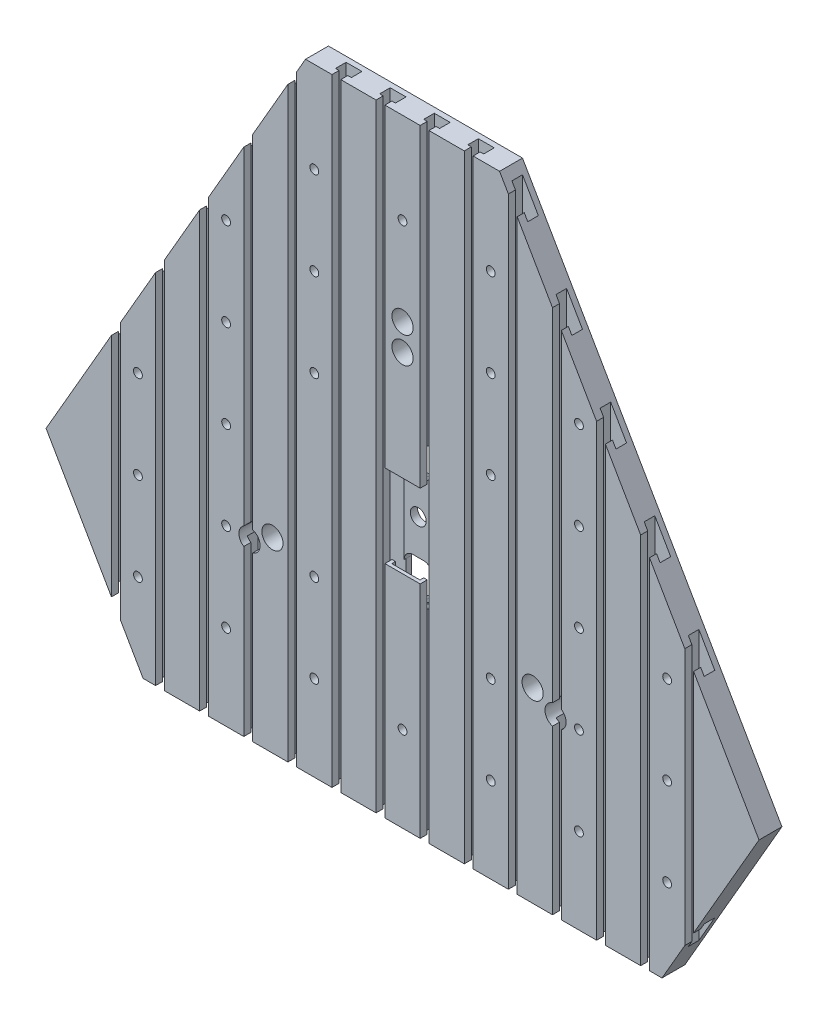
SolidWorks part; units mm, degrees
ref_plane "Plan de face" through (0, 0, 0) normal (0, 0, 1) x (1, 0, 0)
ref_plane "Plan de dessus" through (0, 0, 0) normal (0, 1, 0) x (1, 0, 0)
ref_plane "Plan de droite" through (0, 0, 0) normal (1, 0, 0) x (0, 0, -1)
sketch "Esquisse1" plane through (0, 0, 0) normal (0, 0, 1) x (1, 0, 0)
  line L6 (35.7636, 358.7862) -> (-423.8647, -437.3133) construction
  line L7 (-755.4678, -148.4209) -> (879.7592, -148.4209) construction
  line L8 (-46.1325, 376.7457) -> (415.4529, -422.7436) construction
  line L9 (257.0726, -148.4209) -> (-245.0999, 141.5085) construction
  line L10 (-257.0726, -148.4209) -> (263.2247, 151.9729) construction
  line L11 (-55, 201.5791) -> (55, 201.5791)
  line L12 (-147.0726, -148.4209) -> (147.0726, -148.4209)
  line L13 (147.0726, -148.4209) -> (202.0726, -53.1581)
  line L14 (202.0726, -53.1581) -> (55, 201.5791)
  line L15 (-147.0726, -148.4209) -> (-202.0726, -53.1581)
  line L16 (-202.0726, -53.1581) -> (-55, 201.5791)
  dimension "D1" = 60
  dimension "D2" = 60
  dimension "D3" = 110
  dimension "D4" = 350
  dimension "D5" = 60
  dimension "D6" = 60
  dimension "D7" = 110
  dimension "D8" = 110
extrude "Boss.-Extru.2" add sketch "Esquisse1" along normal blind 13
sketch "Esquisse3" plane through (0, 201.5791, 0) normal (0, 1, 0) x (1, 0, 0)
  line L0 (-12.5, 6.793) -> (-12.5, -19.2478) construction
  line L1 (-8, -3) -> (-17, -3)
  line L2 (-17, -3) -> (-17, -9)
  line L3 (-17, -9) -> (-15, -9)
  line L4 (-15, -9) -> (-15, -13)
  line L5 (55, -13) -> (-55, -13) construction
  line L6 (-10, -9) -> (-10, -13)
  line L7 (-8, -9) -> (-10, -9)
  line L8 (-8, -3) -> (-8, -9)
  line L9 (-15, -13) -> (-10, -13)
  point P2 (-12.5, -13)
  point P14 (-12.5, -3)
  dimension "D1" = 12.5
  dimension "D2" = 9
  dimension "D3" = 5
  dimension "D4" = 6
  dimension "D5" = 4
extrude "Enlèv. mat.-Extru.1" cut sketch "Esquisse3" against normal up to next
pattern_linear "Répétition linéaire1" count 8 spacing 25 along (1, 0, 0) of "Enlèv. mat.-Extru.1"
pattern_linear "Répétition linéaire2" count 7 spacing 25 along (-1, 0, 0) of "Enlèv. mat.-Extru.1"
sketch "3parties" plane through (0, 0, 0) normal (0, 0, 1) x (1, 0, 0)
  line L2 (-50, 0) -> (-171.3817, 0)
  line L3 (-165, 11.0535) -> (-202.0726, -53.1581) construction
  line L4 (50, 0) -> (171.3817, 0)
  line L5 (202.0726, -53.1581) -> (165, 11.0535) construction
  line L6 (0, -50) -> (0, -148.4209)
  line L7 (-10, -148.4209) -> (10, -148.4209) construction
  circle A0 centre (0, 0) radius 50
  dimension "D1" = 100
sketch "certcleRotules" plane through (0, 0, 13) normal (0, 0, 1) x (1, 0, 0)
  circle A0 centre (0, 0) radius 157.5
  dimension "D1" = 315
sketch "Esquisse6" plane through (0, 0, 0) normal (0, 1, 0) x (1, 0, 0)
  line L0 (-157.5, -13) -> (157.5, -13) construction
  line L1 (0, 0) -> (-4.5, 0)
  line L2 (0, 0) -> (0, -13)
  line L3 (-2.5, -9) -> (-4.5, -9)
  line L4 (-4.5, 0) -> (-4.5, -9)
  line L7 (0, -13) -> (-2.5, -13)
  line L8 (-2.5, -9) -> (-2.5, -13)
  dimension "D1" = 4.5
  dimension "D2" = 2.5
  dimension "D3" = 4
revolve "Enlèvement de matière-Révolution1" cut sketch "Esquisse6" angle 360 about L2
pattern_linear "Répétition linéaire3" count 4 spacing 50 along (0, 1, 0) count 4 spacing 50 along (1, 0, 0) of "Enlèvement de matière-Révolution1"
pattern_linear "Répétition linéaire5" count 3 spacing 50 along (0, -1, 0) count 4 spacing 50 along (1, 0, 0) of "Enlèvement de matière-Révolution1"
pattern_linear "Répétition linéaire6" count 4 spacing 50 along (0, 1, 0) count 4 spacing 50 along (-1, 0, 0) of "Enlèvement de matière-Révolution1"
pattern_linear "Répétition linéaire7" count 3 spacing 50 along (0, -1, 0) count 4 spacing 50 along (-1, 0, 0) of "Enlèvement de matière-Révolution1"
sketch "Esquisse8" plane through (0, 0, 0) normal (0, 0, -1) x (-1, 0, 0)
  circle A0 centre (0, 100) radius 4.5 construction
  circle A1 centre (0, 100) radius 4.5
extrude "bouchonBarreauHaut" add sketch "Esquisse8" against normal blind 13
sketch "Esquisse7" plane through (0, 0, 0) normal (0, 0, -1) x (-1, 0, 0)
  line L1 (-6.5, 105.15) -> (6.5, 105.15)
  line L2 (-6.5, 105.15) -> (-6.5, 80.15)
  line L3 (-6.5, 80.15) -> (6.5, 80.15)
  line L4 (6.5, 105.15) -> (6.5, 80.15)
  line L5 (0, 7.15) -> (0, -7.15) construction
  dimension "D1" = 25
  dimension "D2" = 80.15
  dimension "D3" = 13
  dimension "D4" = 6.5
extrude "Boss.-Extru.4" add sketch "Esquisse7" along normal blind 5
sketch "Esquisse9" plane through (0, 0, 0) normal (1, 0, 0) x (0, 0, -1)
  line L0 (5, 80.15) -> (0, 80.15) construction
  line L1 (5, 80.15) -> (5, 105.15) construction
  line L3 (5, 85.15) -> (5, 82.5)
  line L4 (5, 82.5) -> (-3, 82.5)
  line L6 (-3, -148.4209) -> (-3, 201.5791) construction
  line L7 (-13, 157.5) -> (-13, -157.5) construction
  line L8 (-3, 79.15) -> (-13, 79.15)
  line L9 (-3, 79.15) -> (-3, 82.5)
  line L10 (5, 85.15) -> (-13, 85.15)
  line L11 (-13, 79.15) -> (-13, 85.15)
  dimension "D1" = 5
  dimension "D2" = 2.65
  dimension "D3" = 6
revolve "Enlèvement de matière-Révolution2" cut sketch "Esquisse9" angle 360 about L10
pattern_linear "Répétition linéaire8" count 2 spacing 15 along (0, 1, 0) of "Enlèvement de matière-Révolution2"
pattern_circular "Répétition circulaire1" count 3 every 120 about axis through (0, 0, 0) along (0, 0, 1) of "Boss.-Extru.4", "Enlèvement de matière-Révolution2", "Répétition linéaire8"
sketch "Esquisse10" plane through (0, 0, 0) normal (1, 0, 0) x (0, 0, -1)
  line L0 (0, 201.5791) -> (0, -53.1581) construction
  line L1 (0, 77.5) -> (5, 77.5)
  line L2 (0, 77.5) -> (0, 72.5)
  line L3 (0, 72.5) -> (5, 72.5)
  line L4 (5, 77.5) -> (5, 72.5)
  line L5 (0, 50) -> (0, -50) construction
  line L6 (0, -72.5) -> (5, -72.5)
  line L7 (0, -72.5) -> (0, -77.5)
  line L8 (0, -77.5) -> (5, -77.5)
  line L9 (5, -72.5) -> (5, -77.5)
  line L10 (5, 80.15) -> (5, 105.15) construction
  line L11 (-9, 50) -> (0, 50) construction
  line L13 (-9, -100) -> (0, -100) construction
  point P16 (2.5, 72.5)
  point P19 (2.5, -72.5)
  dimension "D1" = 22.5
  dimension "D2" = 5
  dimension "D3" = 22.5
  dimension "D4" = 5
extrude "Boss.-Extru.6" add sketch "Esquisse10" along normal mid plane 215
chamfer "Chanfrein1" distance 5 angle 60 4 edges at (107.5, -75, -5) (-107.5, -75, -5) (-107.5, 75, -5) (107.5, 75, -5)
sketch "Esquisse11" plane through (0, 0, 13) normal (0, 0, 1) x (1, 0, 0)
  line L0 (-10, -148.4209) -> (-10, 201.5791) construction
  line L1 (-10, 23.5) -> (10, 23.5)
  line L2 (-10, 23.5) -> (-10, -23.5)
  line L3 (-10, -23.5) -> (10, -23.5)
  line L4 (10, 23.5) -> (10, -23.5)
  line L5 (10, -148.4209) -> (10, 201.5791) construction
  dimension "D1" = 47
  dimension "D2" = 23.5
extrude "Enlèv. mat.-Extru.2" cut sketch "Esquisse11" against normal blind 8.9
sketch "Esquisse13" plane through (-8, 0, 0) normal (-1, 0, 0) x (0, 0, 1)
  line L1 (4.1, -23.5) -> (11.1, -23.5)
  line L2 (4.1, -23.5) -> (4.1, -40)
  line L3 (4.1, -40) -> (6.1, -40)
  line L4 (11.1, -23.5) -> (11.1, -35)
  arc A0 (6.1, -40) -> (11.1, -35) centre (6.1, -35) ccw
  dimension "D2" = 5
  dimension "D1" = 16.5
  dimension "D3" = 7
extrude "Enlèv. mat.-Extru.3" cut sketch "Esquisse13" against normal up to surface (16 mm away)
sketch "Esquisse14" plane through (0, 0, 4.1) normal (0, 0, 1) x (1, 0, 0)
  line L0 (-8, 23.5) -> (-8, -40) construction
  line L1 (-3, -20) -> (3, -20)
  line L2 (-8, -25) -> (-8, -35)
  line L3 (-3, -40) -> (3, -40)
  line L4 (8, -25) -> (8, -35)
  line L5 (8, -40) -> (8, 23.5) construction
  line L6 (8, -40) -> (-8, -40) construction
  arc A0 (-8, -35) -> (-3, -40) centre (-3, -35) ccw
  arc A1 (3, -40) -> (8, -35) centre (3, -35) ccw
  arc A2 (3, -20) -> (8, -25) centre (3, -25) cw
  arc A3 (-3, -20) -> (-8, -25) centre (-3, -25) ccw
  point P16 (8, -20)
  point P19 (-8, -20)
  dimension "D3" = 5
  dimension "D1" = 20
extrude "Enlèv. mat.-Extru.4" cut sketch "Esquisse14" against normal up to next
mirror "Symétrie1" about plane through (0, 0, 0) normal (0, 1, 0) of "Enlèv. mat.-Extru.4", "Enlèv. mat.-Extru.3"
sketch "Esquisse15" plane through (0, 0, 0) normal (0, 0, -1) x (-1, 0, 0)
  circle A0 centre (-50, 0) radius 4.5 construction
  circle A1 centre (0, -50) radius 4.5 construction
  circle A2 centre (50, 0) radius 4.5 construction
  circle A3 centre (0, 50) radius 4.5 construction
  circle A4 centre (-50, 0) radius 4.5
  circle A5 centre (0, -50) radius 4.5
  circle A6 centre (50, 0) radius 4.5
  circle A7 centre (0, 50) radius 4.5
extrude "boucheTrousCEntre" add sketch "Esquisse15" against normal up to surface (13 mm away)
sketch "Esquisse17" plane through (0, 0, 0) normal (0, 0, -1) x (-1, 0, 0)
  line L0 (-147.0726, -148.4209) -> (-202.0726, -53.1581) construction
  line L1 (-147.0726, -148.4209) -> (-202.0726, -53.1581)
  line L3 (-202.0726, -53.1581) -> (-171.3817, 0)
  line L4 (-147.0726, -148.4209) -> (147.0726, -148.4209)
  line L5 (-171.3817, 0) -> (-50, 0)
  line L7 (50, 0) -> (171.3817, 0) construction
  line L8 (147.0726, -148.4209) -> (202.0726, -53.1581) construction
  line L9 (147.0726, -148.4209) -> (202.0726, -53.1581)
  line L10 (50, 0) -> (171.3817, 0)
  line L11 (202.0726, -53.1581) -> (171.3817, 0)
  arc A0 (50, 0) -> (-50, 0) centre (0, 0) ccw
